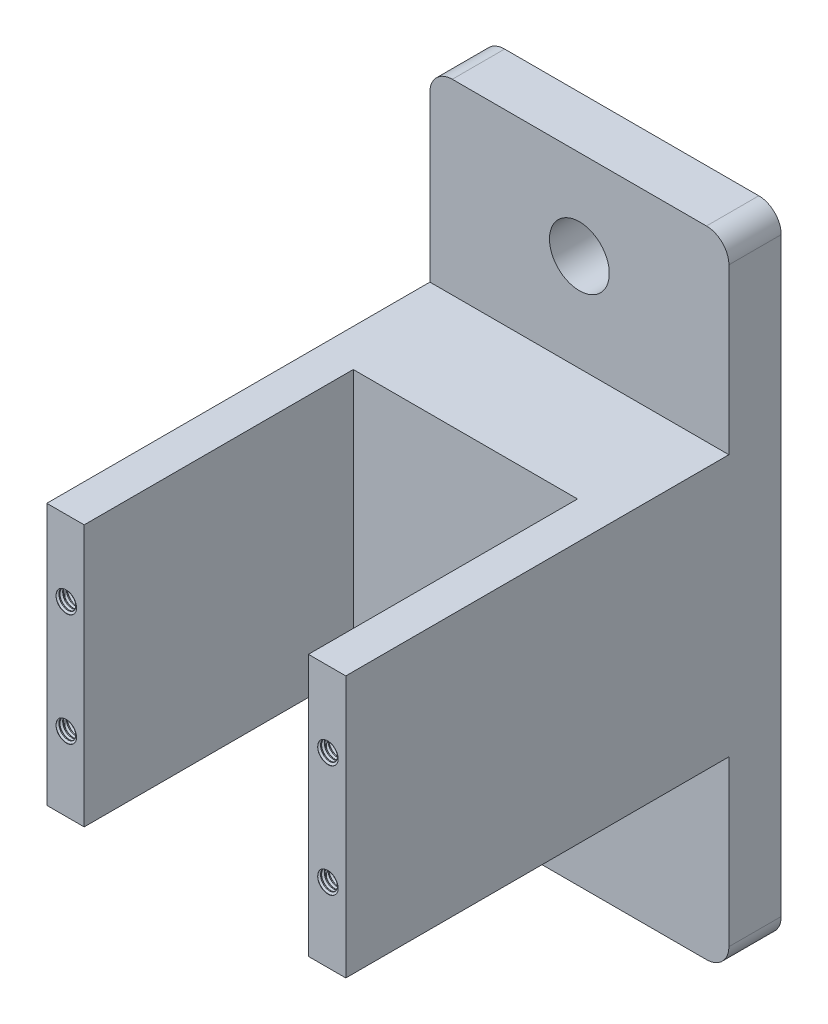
SolidWorks part; units mm, degrees
ref_plane "Front Plane" through (0, 0, 0) normal (0, 0, 1) x (1, 0, 0)
ref_plane "Top Plane" through (0, 0, 0) normal (0, 1, 0) x (1, 0, 0)
ref_plane "Right Plane" through (0, 0, 0) normal (1, 0, 0) x (0, 0, -1)
sketch "Sketch1" plane through (0, 0, 0) normal (0, 0, 1) x (1, 0, 0)
  line L1 (-19.9, -156.0018) -> (20.1, -156.0018)
  line L2 (-19.9, -156.0018) -> (-19.9, -191.0018)
  line L3 (-19.9, -191.0018) -> (20.1, -191.0018)
  line L4 (20.1, -156.0018) -> (20.1, -191.0018)
  dimension "D1" = 40
  dimension "D3" = 35
extrude "Boss-Extrude1" add sketch "Sketch1" along normal up to surface (22.25 mm away)
sketch "Sketch2" plane through (0, 0, 22.25) normal (0, 0, 1) x (1, 0, 0)
  line L0 (-19.9, -191.0018) -> (20.1, -191.0018) construction
  line L1 (-19.9, -156.0018) -> (-14.9, -156.0018)
  line L2 (-19.9, -156.0018) -> (-19.9, -191.0018)
  line L3 (-19.9, -191.0018) -> (-14.9, -191.0018)
  line L4 (-14.9, -156.0018) -> (-14.9, -191.0018)
  line L6 (20.1, -156.0018) -> (15.1, -156.0018)
  line L7 (20.1, -156.0018) -> (20.1, -191.0018)
  line L8 (20.1, -191.0018) -> (15.1, -191.0018)
  line L9 (15.1, -156.0018) -> (15.1, -191.0018)
  dimension "D1" = 30
  dimension "D2" = 5
extrude "Boss-Extrude2" add sketch "Sketch2" along normal blind 36 contours L9 M2 M4 M5 | L4 M2 M3 M4
sketch "Sketch3" plane through (0, 0, 0) normal (0, 0, -1) x (-1, 0, 0)
  line L0 (-20.1, -191.0018) -> (-20.1, -156.0018) construction
  line L1 (19.9, -216.0018) -> (-20.1, -216.0018)
  line L2 (19.9, -216.0018) -> (19.9, -131.0018)
  line L3 (19.9, -131.0018) -> (-20.1, -131.0018)
  line L4 (-20.1, -216.0018) -> (-20.1, -131.0018)
  line L5 (19.9, -156.0018) -> (19.9, -191.0018) construction
  line L6 (19.9, -191.0018) -> (-20.1, -191.0018) construction
  line L7 (-20.1, -156.0018) -> (19.9, -156.0018) construction
  line L8 (-0.1, -131.0018) -> (-0.1, -216.0018) construction
  circle A0 centre (-0.1, -143.0018) radius 4
  circle A1 centre (-0.1, -204.0018) radius 4
  dimension "D3" = 8
  dimension "D5" = 8
  dimension "D1" = 25
  dimension "D2" = 25
  dimension "D4" = 12
  dimension "D6" = 12
extrude "Boss-Extrude3" add sketch "Sketch3" against normal blind 7
sketch "Sketch4" plane through (0, 0, 58.25) normal (0, 0, 1) x (1, 0, 0)
  line L0 (-17.4, -156.0018) -> (-17.4, -191.0018) construction
  line L1 (-14.9, -156.0018) -> (-19.9, -156.0018) construction
  line L2 (-19.9, -191.0018) -> (-14.9, -191.0018) construction
  line L3 (17.6, -156.0018) -> (17.6, -191.0018) construction
  line L4 (20.1, -156.0018) -> (15.1, -156.0018) construction
  line L5 (15.1, -191.0018) -> (20.1, -191.0018) construction
  circle A0 centre (-17.4, -166.0018) radius 1.25
  circle A1 centre (-17.4, -181.0018) radius 1.25
  circle A2 centre (17.6, -166.0018) radius 1.25
  circle A3 centre (17.6, -181.0018) radius 1.25
  dimension "D1" = 2.5
  dimension "D2" = 2.5
  dimension "D3" = 2.5
  dimension "D4" = 2.5
  dimension "D5" = 10
  dimension "D6" = 10
  dimension "D7" = 10
  dimension "D8" = 10
extrude "Cut-Extrude1" cut sketch "Sketch4" against normal blind 10
thread "Thread1" pitch 0.5 start angle 0, offset 10, length 20, pitch 0.5, diameter 2.5
ref_plane "Plane1" through (16.35, -166.0018, 68.25) normal (0, -1, 0) x (-1, 0, 0)
sketch "Thread Profile1" plane through (16.35, -166.0018, 68.25) normal (0, -1, 0) x (-1, 0, 0)
  line L0 (0, 0) -> (0, 0.5) construction
  line L1 (0, 0) -> (0.2706, 0.1562)
  line L2 (0.2706, 0.1562) -> (0.2706, 0.2187)
  line L3 (0.2706, 0.2187) -> (0, 0.375)
  line L4 (0.2706, 0.1875) -> (0, 0.1875) construction
  line L11 (0, 0) -> (0, 0.375)
  point P2 (0, 0)
  dimension "Pitch" = 0.5
  dimension "Profile_Angle" = 60
  dimension "Profile_Land" = 0.0625
  dimension "Profile_Height" = 0.2706
thread "Thread2" pitch 0.5 start angle 0, offset 10, length 20, pitch 0.5, diameter 2.5
ref_plane "Plane2" through (16.35, -181.0018, 68.25) normal (0, -1, 0) x (-1, 0, 0)
sketch "Thread Profile2" plane through (16.35, -181.0018, 68.25) normal (0, -1, 0) x (-1, 0, 0)
  line L0 (0, 0) -> (0, 0.5) construction
  line L1 (0, 0) -> (0.2706, 0.1562)
  line L2 (0.2706, 0.1562) -> (0.2706, 0.2187)
  line L3 (0.2706, 0.2187) -> (0, 0.375)
  line L4 (0.2706, 0.1875) -> (0, 0.1875) construction
  line L11 (0, 0) -> (0, 0.375)
  point P2 (0, 0)
  dimension "Pitch" = 0.5
  dimension "Profile_Angle" = 60
  dimension "Profile_Land" = 0.0625
  dimension "Profile_Height" = 0.2706
thread "Thread3" pitch 0.5 start angle 0, offset 10, length 20, pitch 0.5, diameter 2.5
ref_plane "Plane3" through (-18.65, -181.0018, 68.25) normal (0, -1, 0) x (-1, 0, 0)
sketch "Thread Profile3" plane through (-18.65, -181.0018, 68.25) normal (0, -1, 0) x (-1, 0, 0)
  line L0 (0, 0) -> (0, 0.5) construction
  line L1 (0, 0) -> (0.2706, 0.1562)
  line L2 (0.2706, 0.1562) -> (0.2706, 0.2187)
  line L3 (0.2706, 0.2187) -> (0, 0.375)
  line L4 (0.2706, 0.1875) -> (0, 0.1875) construction
  line L11 (0, 0) -> (0, 0.375)
  point P2 (0, 0)
  dimension "Pitch" = 0.5
  dimension "Profile_Angle" = 60
  dimension "Profile_Land" = 0.0625
  dimension "Profile_Height" = 0.2706
thread "Thread4" pitch 0.5 start angle 0, offset 10, length 20, pitch 0.5, diameter 2.5
ref_plane "Plane4" through (-18.65, -166.0018, 68.25) normal (0, -1, 0) x (-1, 0, 0)
sketch "Thread Profile4" plane through (-18.65, -166.0018, 68.25) normal (0, -1, 0) x (-1, 0, 0)
  line L0 (0, 0) -> (0, 0.5) construction
  line L1 (0, 0) -> (0.2706, 0.1562)
  line L2 (0.2706, 0.1562) -> (0.2706, 0.2187)
  line L3 (0.2706, 0.2187) -> (0, 0.375)
  line L4 (0.2706, 0.1875) -> (0, 0.1875) construction
  line L11 (0, 0) -> (0, 0.375)
  point P2 (0, 0)
  dimension "Pitch" = 0.5
  dimension "Profile_Angle" = 60
  dimension "Profile_Land" = 0.0625
  dimension "Profile_Height" = 0.2706
fillet "Fillet1" radius 3 4 edges at (-19.9, -131.0018, 3.5) (20.1, -131.0018, 3.5) (-19.9, -216.0018, 3.5) (20.1, -216.0018, 3.5)
